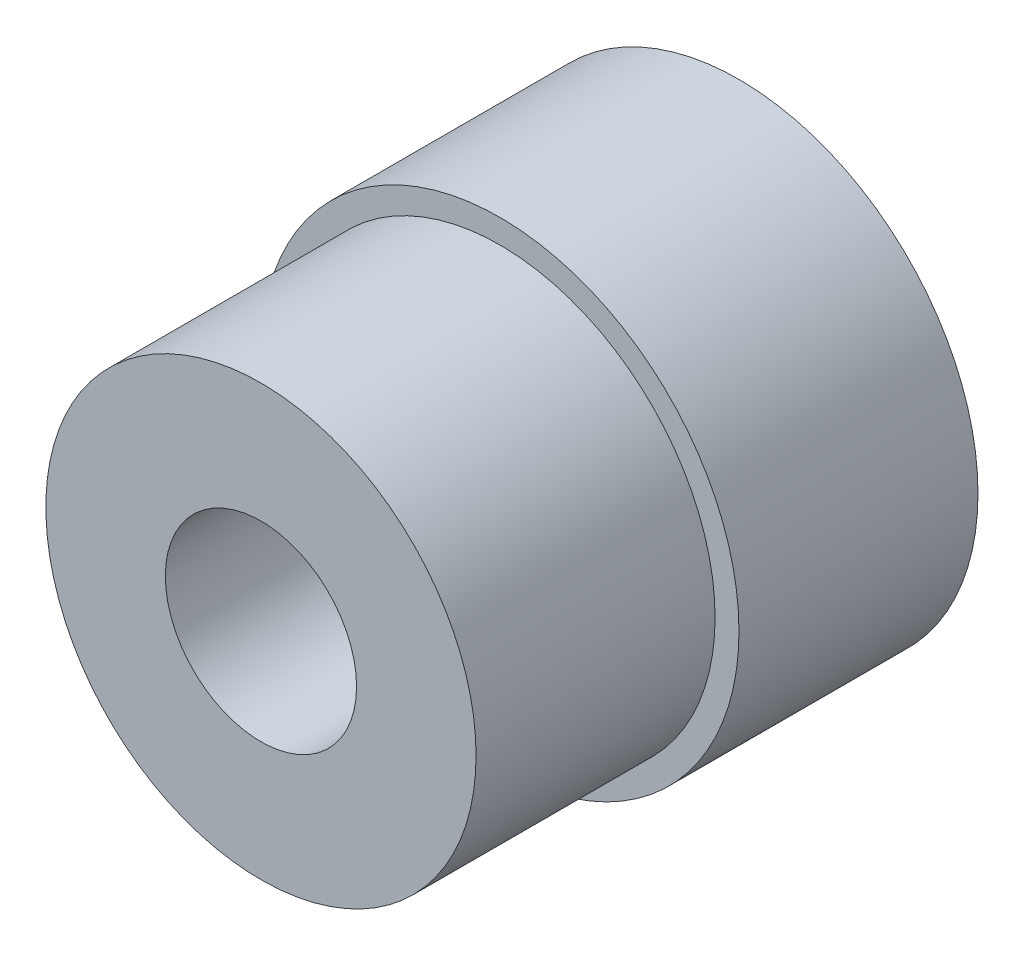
SolidWorks part; units mm, degrees
ref_plane "前视基准面" through (0, 0, 0) normal (0, 0, 1) x (1, 0, 0)
ref_plane "上视基准面" through (0, 0, 0) normal (0, 1, 0) x (1, 0, 0)
ref_plane "右视基准面" through (0, 0, 0) normal (1, 0, 0) x (0, 0, -1)
sketch "草图1" plane through (0, 0, 0) normal (0, 0, 1) x (1, 0, 0)
  circle A0 centre (0, 0) radius 10
extrude "凸台-拉伸1" add sketch "草图1" along normal blind 10
sketch "草图2" plane through (0, 0, 10) normal (0, 0, 1) x (1, 0, 0)
  circle A0 centre (0, 0) radius 4
  circle A1 centre (0, 0) radius 9
extrude "凸台-拉伸2" add sketch "草图2" along normal blind 10
